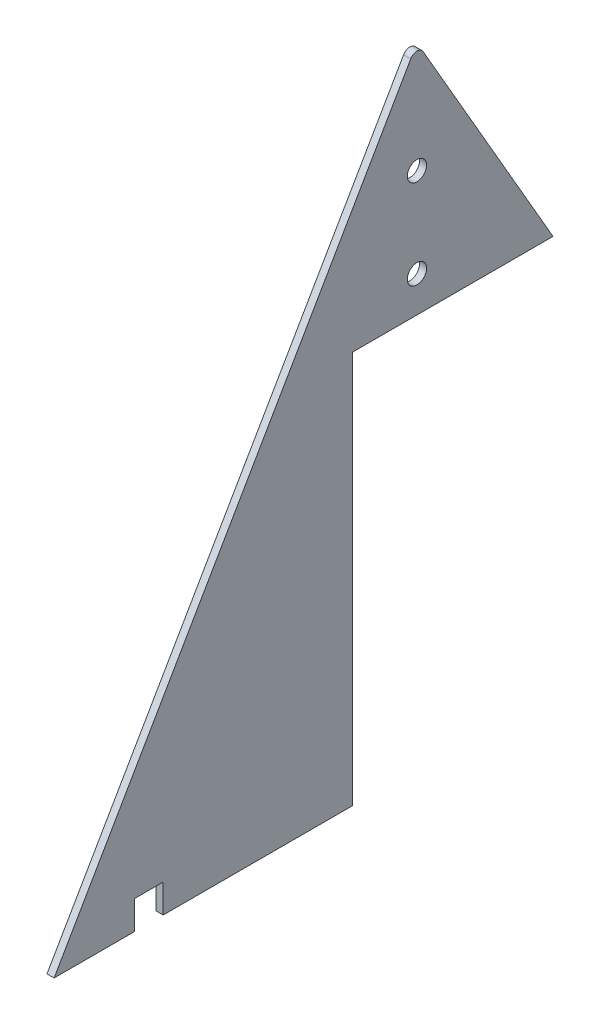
SolidWorks part; units mm, degrees
ref_plane "Front Plane" through (0, 0, 0) normal (0, 0, 1) x (1, 0, 0)
ref_plane "Top Plane" through (0, 0, 0) normal (0, 1, 0) x (1, 0, 0)
ref_plane "Right Plane" through (0, 0, 0) normal (1, 0, 0) x (0, 0, -1)
sketch "Sketch1" plane through (0, 0, 0) normal (1, 0, 0) x (0, 0, -1)
  line L0 (-1.7321, 173) -> (-101.6136, 0)
  line L1 (-101.6136, 0) -> (0, 0)
  line L2 (0, 0) -> (101.6136, 0)
  line L3 (101.6136, 0) -> (1.7321, 173)
  arc A0 (1.7321, 173) -> (-1.7321, 173) centre (0, 172) ccw
  dimension "D4" = 2
  dimension "D3" = 172
  dimension "D1" = 60
  dimension "D2" = 60
extrude "Boss-Extrude1" add sketch "Sketch1" along normal blind 2
sketch "Sketch2" plane through (2, 0, 0) normal (1, 0, 0) x (0, 0, -1)
  line L0 (101.6136, 0) -> (38.1051, 110)
  line L1 (101.6136, 0) -> (1.7321, 173) construction
  line L2 (38.1051, 110) -> (-18, 110)
  line L3 (-18, 110) -> (-18, 0)
  line L4 (-101.6136, 0) -> (101.6136, 0) construction
  line L5 (-18, 0) -> (101.6136, 0)
  dimension "D1" = 110
  dimension "D2" = 18
extrude "Cut-Extrude1" cut sketch "Sketch2" against normal through all
sketch "Sketch3" plane through (2, 0, 0) normal (1, 0, 0) x (0, 0, -1)
  line L0 (-101.6136, 0) -> (18, 0)
  line L3 (-101.6136, 0) -> (-18, 0) construction
  line L4 (18, 0) -> (18, 110)
  line L5 (18, 110) -> (-38.1051, 110)
  line L6 (-1.7321, 173) -> (-101.6136, 0) construction
  line L7 (-38.1051, 110) -> (-101.6136, 0)
  dimension "D1" = 18
  dimension "D2" = 110
extrude "Cut-Extrude2" [suppressed] cut sketch "Sketch3" against normal through all
hole_wizard " (5.4) Diameter Hole2" positions "Sketch5" profile "Sketch4" hole size "Ø5.4" standard "ANSI Metric"
sketch "Sketch5" plane through (2, 0, 0) normal (1, 0, 0) x (0, 0, -1)
  line L0 (0, 0) -> (0, 120) construction
  line L1 (0, 120) -> (0, 145) construction
  point P0 (0, 145)
  point P2 (0, 120)
  dimension "D1" = 120
  dimension "D2" = 25
sketch "Sketch4" plane through (2, 145, 0) normal (0, 1, 0) x (0, 0, -1)
  line L0 (0, 0) -> (0, 2)
  line L1 (0, 2) -> (2.7, 2)
  line L2 (2.7, 2) -> (2.7, 0)
  line L5 (2.7, 0) -> (0, 0)
  line L11 (0, -6.35) -> (0, 107.95) construction
  dimension "Thru Hole Dia." = 5.4
  dimension "Thru Hole Depth" = 2
hole_wizard " (5.4) Diameter Hole1" positions "Sketch7" profile "Sketch6" hole size "Ø4.0" standard "ANSI Metric"
sketch "Sketch7" plane through (2, 0, 0) normal (1, 0, 0) x (0, 0, -1)
  line L0 (0, 0) -> (0, 120) construction
  line L1 (0, 120) -> (0, 145) construction
  point P0 (0, 120)
  point P2 (0, 145)
  dimension "D1" = 120
  dimension "D2" = 25
sketch "Sketch6" plane through (2, 120, 0) normal (0, 1, 0) x (0, 0, -1)
  line L0 (0, 0) -> (0, 2)
  line L1 (0, 2) -> (2.7, 2)
  line L2 (2.7, 2) -> (2.7, 0)
  line L5 (2.7, 0) -> (0, 0)
  line L11 (0, -6.35) -> (0, 107.95) construction
  dimension "Thru Hole Dia." = 4
  dimension "Thru Hole Depth" = 12
sketch "Sketch8" plane through (0, 0, 0) normal (-1, 0, 0) x (0, 0, 1)
  line L1 (79.0734, 8) -> (71.0734, 8)
  line L2 (79.0734, 8) -> (79.0734, 0)
  line L3 (79.0734, 0) -> (71.0734, 0)
  line L4 (71.0734, 8) -> (71.0734, 0)
extrude "Cut-Extrude3" cut sketch "Sketch8" against normal up to surface (2 mm away)
